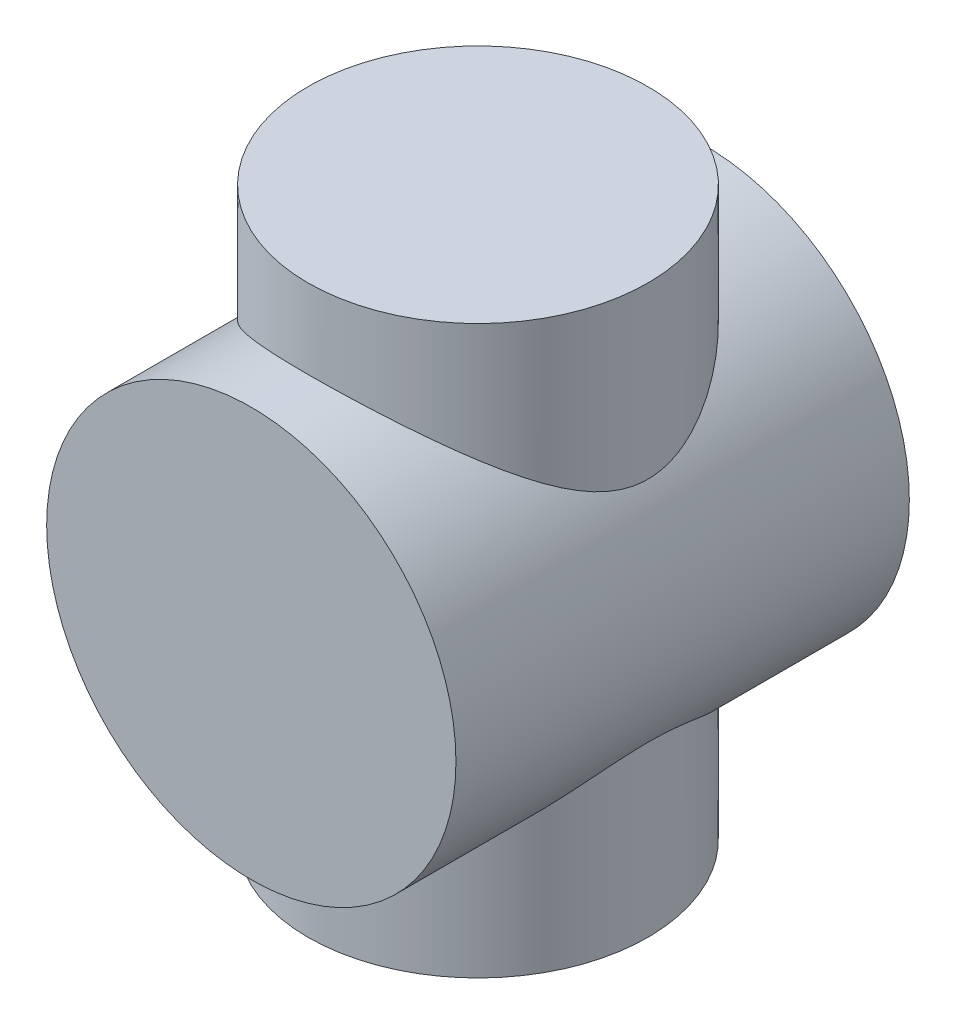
SolidWorks part; units mm, degrees
ref_plane "前视基准面" through (0, 0, 0) normal (0, 0, 1) x (1, 0, 0)
ref_plane "上视基准面" through (0, 0, 0) normal (0, 1, 0) x (1, 0, 0)
ref_plane "右视基准面" through (0, 0, 0) normal (1, 0, 0) x (0, 0, -1)
sketch "草图1" plane through (0, 0, 0) normal (0, 0, 1) x (1, 0, 0)
  line L0 (0, 83.2971) -> (0, -69.85) construction
  line L1 (0, 48.1853) -> (-15, 48.1853)
  line L2 (-15, 48.1853) -> (-15, -1.8147)
  line L3 (-15, -1.8147) -> (0, -1.8147)
  line L4 (0, 48.1853) -> (0, -1.8147)
  dimension "D1" = 15
  dimension "D2" = 50
revolve "旋转1" add sketch "草图1" angle 360 about L0
sketch "草图2" plane through (0, 0, 0) normal (0, 0, 1) x (1, 0, 0)
  line L0 (0, 50.0019) -> (0, -3.7274) construction
  line L1 (-20.2326, 23.1853) -> (21.1938, 23.1853) construction
  line L2 (-15, -1.8147) -> (15, -1.8147) construction
  circle A0 centre (0, 23.1372) radius 18.0537
  point P7 (0, 23.1853)
  point P8 (0, 23.1853)
  dimension "D1" = 41.4264
  dimension "D2" = 25
extrude "拉伸1" add sketch "草图2" along normal mid plane 40
